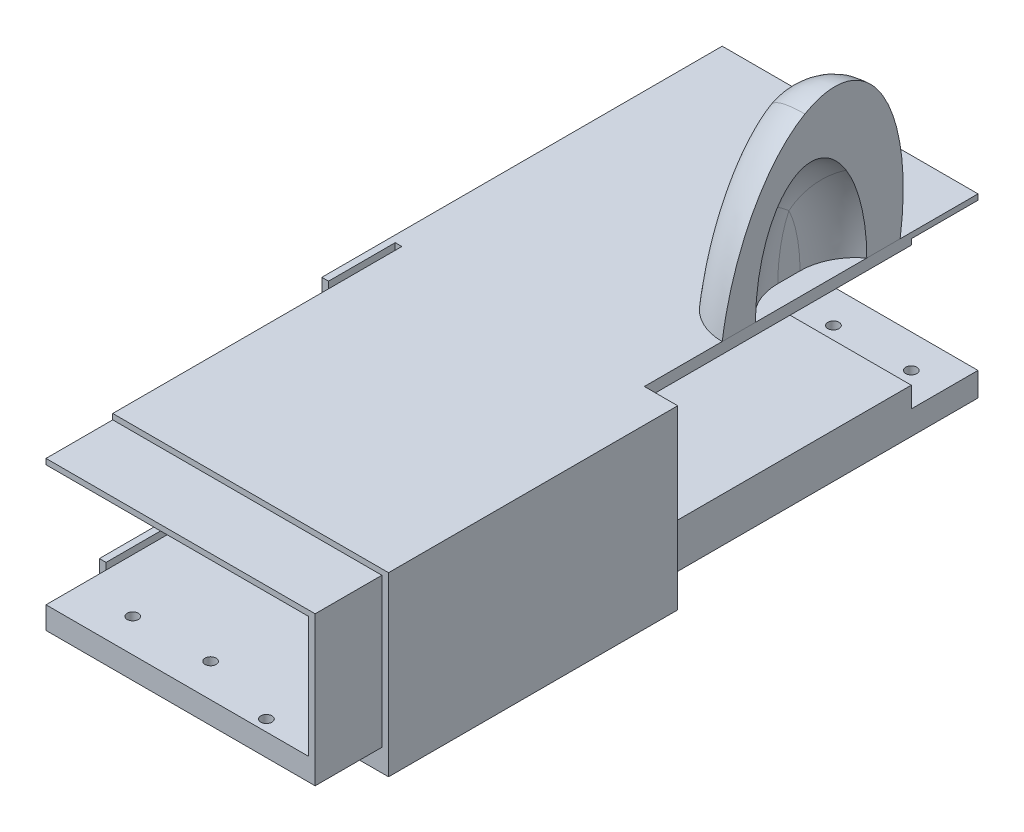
SolidWorks part; units mm, degrees
ref_plane "前视基准面" through (0, 0, 0) normal (0, 0, 1) x (1, 0, 0)
ref_plane "上视基准面" through (0, 0, 0) normal (0, 1, 0) x (1, 0, 0)
ref_plane "右视基准面" through (0, 0, 0) normal (1, 0, 0) x (0, 0, -1)
sketch "草图1" plane through (0, 0, 1670) normal (0, 0, 1) x (1, 0, 0)
  line L0 (-122.3024, 63.0247) -> (7.6976, 63.0247) construction
  line L1 (-122.3024, 142.5174) -> (7.6976, 142.5174)
  line L2 (-122.3024, 142.5174) -> (-122.3024, 63.0247)
  line L3 (-122.3024, 63.0247) -> (7.6976, 63.0247)
  line L4 (7.6976, 142.5174) -> (7.6976, 63.0247)
  line L5 (-119.3024, 140.0174) -> (4.6976, 140.0174)
  line L6 (-119.3024, 140.0174) -> (-119.3024, 73.7735)
  line L7 (-119.3024, 73.7735) -> (4.6976, 73.7735)
  line L8 (4.6976, 140.0174) -> (4.6976, 73.7735)
  dimension "D1" = 3
  dimension "D2" = 0
extrude "凸台-拉伸1" add sketch "草图1" along normal blind 30
sketch "草图2" plane through (0, 0, 1700) normal (0, 0, 1) x (1, 0, 0)
  line L1 (-122.3024, 142.5174) -> (7.6976, 142.5174)
  line L2 (-122.3024, 142.5174) -> (-122.3024, 63.0247)
  line L3 (-122.3024, 63.0247) -> (7.6976, 63.0247)
  line L4 (7.6976, 142.5174) -> (7.6976, 63.0247)
  line L5 (-116.3024, 137.5174) -> (1.6976, 137.5174)
  line L6 (-116.3024, 137.5174) -> (-116.3024, 83.0247)
  line L7 (-116.3024, 83.0247) -> (1.6976, 83.0247)
  line L8 (1.6976, 137.5174) -> (1.6976, 83.0247)
extrude "凸台-拉伸2" add sketch "草图2" along normal blind 250
sketch "草图3" plane through (0, 0, 1950) normal (0, 0, 1) x (1, 0, 0)
  line L0 (-122.3024, 63.0247) -> (7.6976, 63.0247) construction
  line L1 (-119.3024, 140.0174) -> (4.6976, 140.0174)
  line L2 (-119.3024, 140.0174) -> (-119.3024, 73.0247)
  line L3 (-119.3024, 73.0247) -> (4.6976, 73.0247)
  line L4 (4.6976, 140.0174) -> (4.6976, 73.0247)
  line L5 (-122.3024, 142.5174) -> (-122.3024, 63.0247) construction
  line L6 (7.6976, 63.0247) -> (7.6976, 142.5174) construction
  line L7 (7.6976, 142.5174) -> (-122.3024, 142.5174) construction
  line L9 (-116.3024, 137.5174) -> (1.6976, 137.5174)
  line L10 (-116.3024, 137.5174) -> (-116.3024, 83.0247)
  line L11 (-116.3024, 83.0247) -> (1.6976, 83.0247)
  line L12 (1.6976, 137.5174) -> (1.6976, 83.0247)
  dimension "D1" = 10
  dimension "D2" = 3
  dimension "D3" = 3
  dimension "D4" = 2.5
extrude "凸台-拉伸3" add sketch "草图3" along normal blind 30
sketch "草图4" plane through (0, 63.0247, 0) normal (0, -1, 0) x (1, 0, 0)
  line L0 (-122.3024, 1670) -> (7.6976, 1670) construction
  line L1 (7.6976, 1950) -> (7.6976, 1670) construction
  line L2 (-122.3024, 1950) -> (-122.3024, 1670) construction
  circle A0 centre (-92.3024, 1685) radius 5.5
  circle A1 centre (-57.3024, 1685) radius 5.5
  circle A2 centre (-22.3024, 1685) radius 5.5
  circle A3 centre (-22.3024, 1405) radius 5.5 construction
  circle A4 centre (-57.3024, 1405) radius 5.5 construction
  circle A5 centre (-92.3024, 1405) radius 5.5 construction
  dimension "D1" = 11
  dimension "D2" = 11
  dimension "D3" = 11
  dimension "D4" = 0
  dimension "D5" = 0
  dimension "D6" = 0
  dimension "D7" = 15
  dimension "D8" = 15
  dimension "D9" = 15
  dimension "D10" = 65
  dimension "D11" = 30
extrude "切除-拉伸1" cut sketch "草图4" against normal blind 2.5
sketch "草图5" plane through (0, 65.5247, 0) normal (0, -1, 0) x (1, 0, 0)
  circle A0 centre (-92.3024, 1685) radius 2.5
  circle A1 centre (-57.3024, 1685) radius 2.5
  circle A2 centre (-22.3024, 1685) radius 2.5
  dimension "D1" = 5
  dimension "D2" = 5
  dimension "D3" = 5
extrude "切除-拉伸2" cut sketch "草图5" against normal up to next
sketch "草图6" plane through (0, 73.0247, 0) normal (0, -1, 0) x (1, 0, 0)
  circle A0 centre (-92.3024, 1965) radius 2.5
  circle A1 centre (-57.3024, 1965) radius 2.5
  circle A2 centre (-22.2811, 1974.9353) radius 2.5
extrude "切除-拉伸3" cut sketch "草图6" against normal up to next
sketch "草图7" plane through (0, 142.5174, 0) normal (0, 1, 0) x (1, 0, 0)
  line L0 (-122.3024, -1950) -> (-122.3024, -1670) construction
  line L1 (-122.3024, -1850) -> (-116.3024, -1850)
  line L2 (-122.3024, -1850) -> (-122.3024, -1980)
  line L3 (-122.3024, -1980) -> (-116.3024, -1980)
  line L4 (-116.3024, -1850) -> (-116.3024, -1980)
  line L5 (4.6976, -1980) -> (-119.3024, -1980) construction
  line L6 (7.6976, -1950) -> (-122.3024, -1950) construction
  dimension "D1" = 0
  dimension "D2" = 6
  dimension "D3" = 0
  dimension "D4" = 100
extrude "切除-拉伸4" cut sketch "草图7" against normal offset from surface (74.4927 mm away) 5
sketch "草图8" plane through (0, 142.5174, 0) normal (0, 1, 0) x (1, 0, 0)
  line L1 (-116.3024, -1850) -> (-119.3024, -1850)
  line L2 (-116.3024, -1850) -> (-116.3024, -1820)
  line L3 (-116.3024, -1820) -> (-119.3024, -1820)
  line L4 (-119.3024, -1850) -> (-119.3024, -1820)
  dimension "D1" = 3
  dimension "D2" = 30
extrude "切除-拉伸5" cut sketch "草图8" against normal offset from surface (74.4927 mm away) 5
sketch "草图9" plane through (0, 68.0247, 0) normal (0, 1, 0) x (1, 0, 0)
  line L1 (-119.3024, -1850) -> (-122.3024, -1850)
  line L2 (-119.3024, -1850) -> (-119.3024, -1950)
  line L3 (-119.3024, -1950) -> (-122.3024, -1950)
  line L4 (-122.3024, -1850) -> (-122.3024, -1950)
extrude "凸台-拉伸4" add sketch "草图9" along normal up to surface (15 mm away)
sketch "草图10" plane through (7.6976, 0, 0) normal (1, 0, 0) x (0, 0, -1)
  line L0 (-1950, 63.0247) -> (-1670, 63.0247) construction
  line L1 (-1670, 142.5174) -> (-1820, 142.5174)
  line L2 (-1670, 142.5174) -> (-1670, 63.0247)
  line L3 (-1670, 63.0247) -> (-1820, 63.0247)
  line L4 (-1820, 142.5174) -> (-1820, 63.0247)
  dimension "D1" = 150
extrude "切除-拉伸6" cut sketch "草图10" against normal blind 15
sketch "草图12" plane through (-7.3024, 0, 0) normal (1, 0, 0) x (0, 0, -1)
  line L0 (-1670, 142.5174) -> (-1820, 142.5174) construction
  line L1 (-1785, 142.5174) -> (-1705, 142.5174)
  ellipse E0 centre (-1745, 142.5174) end of major axis (-1730.2704, 216.0568) minor radius 39.4379 (-1785, 142.5174) -> (-1705, 142.5174) cw
  dimension "D1" = 75
  dimension "D2" = 40
extrude "凸台-拉伸5" add sketch "草图12" against normal blind 25 separate body
sketch "草图13" plane through (-7.3024, 0, 0) normal (1, 0, 0) x (0, 0, -1)
  line L0 (-1785, 142.5174) -> (-1705, 142.5174) construction
  line L1 (-1770, 142.5174) -> (-1720, 142.5174)
  ellipse E0 centre (-1745, 142.5174) end of major axis (-1745, 92.5174) minor radius 25 (-1770, 142.5174) -> (-1720, 142.5174) cw
  dimension "D1" = 50
  dimension "D2" = 50
extrude "切除-拉伸7" cut sketch "草图13" against normal blind 10
fillet "圆角1" radius 25 2 edges at (-32.3024, 216.4635, 1734.4018) (-17.3024, 192.5174, 1745)
sketch "草图14" plane through (0, 63.0247, 0) normal (0, -1, 0) x (-1, 0, 0)
  circle A0 centre (99.8024, -1885.75) radius 1.6
extrude "切除-拉伸8" cut sketch "草图14" against normal up to next
